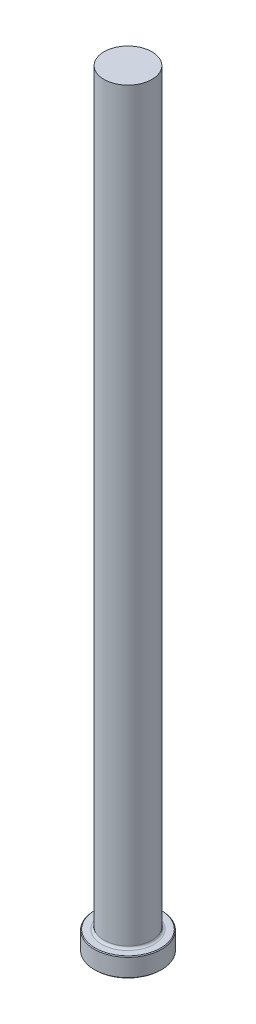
SolidWorks part; units mm, degrees
ref_plane "Front Plane" through (0, 0, 0) normal (0, 0, 1) x (1, 0, 0)
ref_plane "Top Plane" through (0, 0, 0) normal (0, 1, 0) x (1, 0, 0)
ref_plane "Right Plane" through (0, 0, 0) normal (1, 0, 0) x (0, 0, -1)
sketch "Sketch1" plane through (0, 0, 0) normal (0, 0, 1) x (1, 0, 0)
  line L0 (0, 259.9588) -> (0, -15.1925) construction
  line L1 (0, 0) -> (-11.1125, 0)
  line L2 (-11.1125, 0) -> (-11.1125, 6.35)
  line L3 (-11.1125, 6.35) -> (-7.9375, 6.35)
  line L4 (-7.9375, 6.35) -> (-7.9375, 254)
  line L5 (-7.9375, 254) -> (0, 254)
  line L6 (0, 254) -> (0, 0)
  dimension "L" = 254
  dimension "H" = 22.225
  dimension "T" = 6.35
  dimension "D" = 15.875
revolve "Revolve1" add sketch "Sketch1" angle 360 about L0
chamfer "Chamfer1" distance 0.254 angle 45 2 edges at (0, 6.35, 11.1125) (0, 0, 11.1125)
fillet "Fillet1" radius 0.762 1 edges at (0, 6.35, 7.9375)
sketch "Pocket Sketch" plane through (0, 0, 0) normal (0, 0, 1) x (1, 0, 0)
  line L0 (-11.5094, 0) -> (-11.5094, 6.3754)
  line L1 (-11.5094, 6.3754) -> (-9.0964, 6.3754)
  line L2 (-8.3344, 7.1374) -> (-8.3344, 22.225)
  line L3 (-8.3344, 22.225) -> (0, 22.225)
  line L4 (0, 22.225) -> (0, 0)
  line L5 (0, 0) -> (-11.5094, 0)
  line L6 (0, 12.6104) -> (0, -2.4989) construction
  line L7 (-11.1125, 6.096) -> (-11.1125, 0.254) construction
  line L8 (10.8585, 6.35) -> (-10.8585, 6.35) construction
  line L9 (-7.9375, 254) -> (-7.9375, 7.112) construction
  line L10 (-9.0964, 6.3754) -> (-8.3344, 7.1374)
  point P3 (-8.3344, 6.3754)
  dimension "D1" = 23.0187
  dimension "D2" = 0.3969
  dimension "D3" = 0.0254
  dimension "D4" = 0.3969
  dimension "D5" = 16.6687
  dimension "D6" = 22.225
